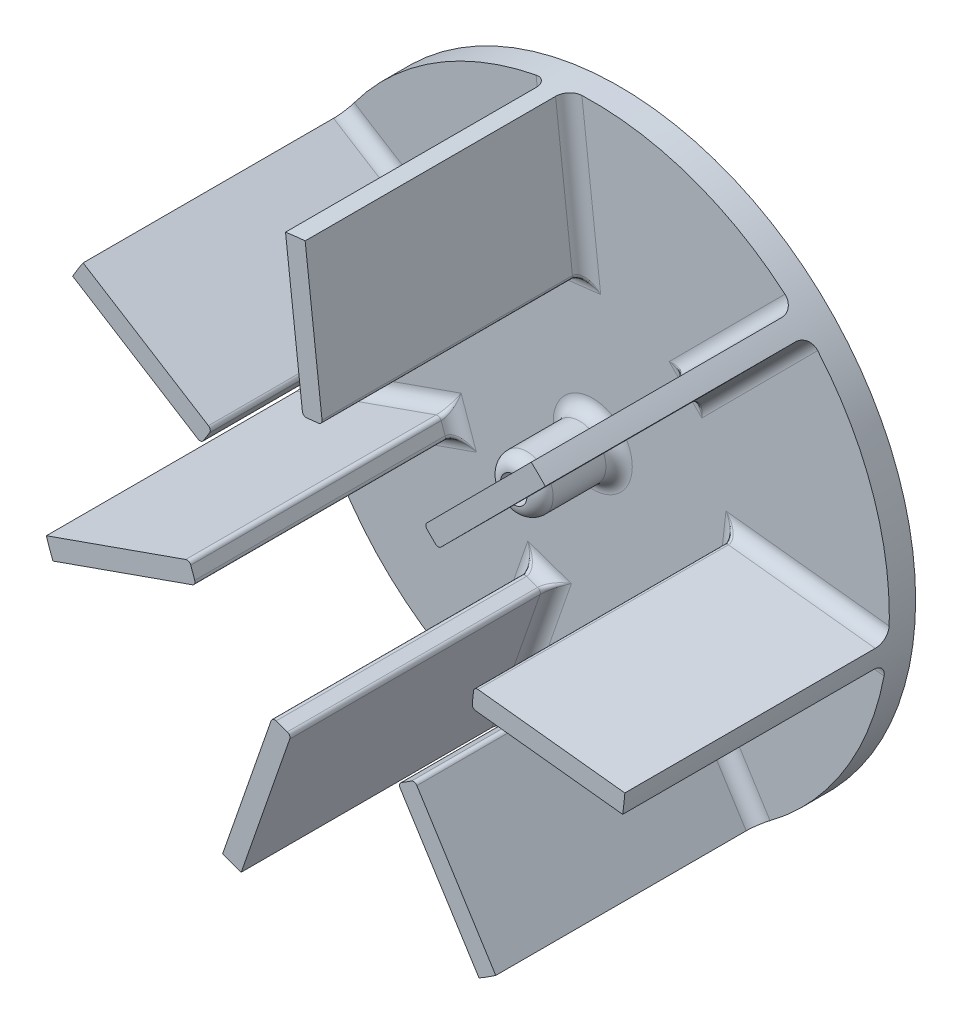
SolidWorks part; units mm, degrees
ref_plane "Front Plane" through (0, 0, 0) normal (0, 0, 1) x (1, 0, 0)
ref_plane "Top Plane" through (0, 0, 0) normal (0, 1, 0) x (1, 0, 0)
ref_plane "Right Plane" through (0, 0, 0) normal (1, 0, 0) x (0, 0, -1)
sketch "Sketch2" plane through (0, 0, 0) normal (0, 0, 1) x (1, 0, 0)
  circle A0 centre (0, 0) radius 22.5
  circle A1 centre (0, 0) radius 1.1
  dimension "D1" = 45
  dimension "D2" = 2.2
extrude "Boss-Extrude1" add sketch "Sketch2" against normal blind 2
sketch "Sketch5" plane through (0, 0, 0) normal (0, 0, 1) x (1, 0, 0)
  circle A0 centre (0, 0) radius 1
  circle A1 centre (0, 0) radius 2
  dimension "D1" = 4
  dimension "D2" = 2
extrude "Boss-Extrude3" add sketch "Sketch5" along normal blind 6
fillet "Fillet6" radius 1 2 edges at (2, 0, 6) (2, 0, 0)
sketch "Sketch6" plane through (0, 0, 0) normal (0, 0, 1) x (1, 0, 0)
  line L0 (0, 0) -> (11.6116, 11.6627) construction
  line L1 (8.2745, 7.2479) -> (16.3976, 15.4068)
  line L2 (7.2115, 8.3063) -> (15.3346, 16.4651)
  line L3 (7.2115, 8.3063) -> (8.2745, 7.2479)
  circle A0 centre (0, 0) radius 11 construction
  circle A2 centre (0, 0) radius 22.5 construction
  arc A3 (16.3976, 15.4068) -> (15.3346, 16.4651) centre (0, 0) ccw
  dimension "D1" = 0.75
  dimension "D3" = 22
  dimension "D2" = 0.75
extrude "Boss-Extrude4" add sketch "Sketch6" along normal blind 20
fillet "Fillet7" radius 1 3 edges at (11.2731, 12.3857, 0) (7.743, 7.7771, 0) (12.3361, 11.3274, 0)
fillet "Fillet8" radius 0.3 4 edges at (6.7973, 8.3054, 0.2929) (8.2754, 6.8337, 0.2929) (7.2115, 8.3063, 10.5) (8.2745, 7.2479, 10.5)
pattern_circular "CirPattern2" count 7 over 360 about axis through (0, 0, 0) along (0, 0, 1) of "Boss-Extrude4", "Fillet7", "Fillet8"
